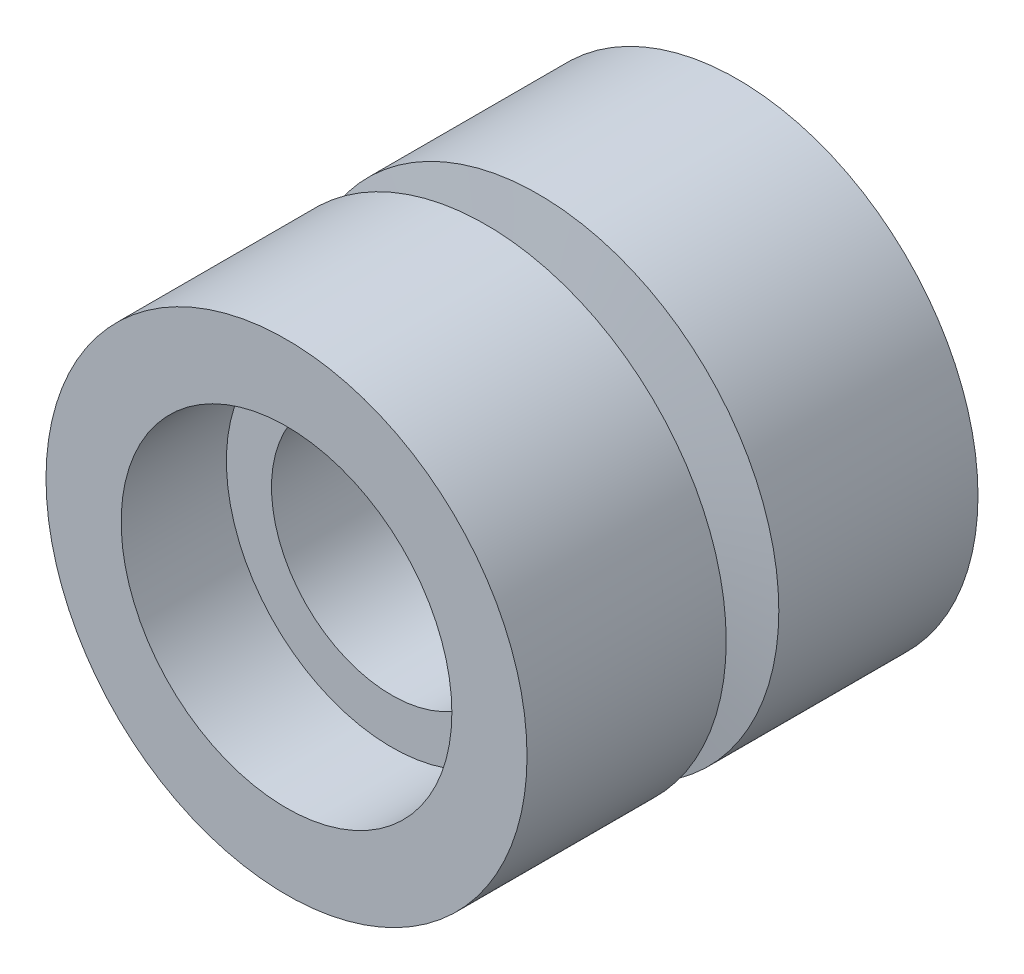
SolidWorks part; units mm, degrees
ref_plane "Plan de face" through (0, 0, 0) normal (0, 0, 1) x (1, 0, 0)
ref_plane "Plan de dessus" through (0, 0, 0) normal (0, 1, 0) x (1, 0, 0)
ref_plane "Plan de droite" through (0, 0, 0) normal (1, 0, 0) x (0, 0, -1)
sketch "Esquisse1" plane through (0, 0, 0) normal (1, 0, 0) x (0, 0, -1)
  line L0 (-21.7008, 0) -> (26.2005, 0) construction
  line L1 (-15, 11) -> (-15, 16)
  line L2 (-15, 16) -> (-1.75, 16)
  line L3 (-1.75, 16) -> (-1.1176, 11.5)
  line L4 (-1.1176, 11.5) -> (1.1176, 11.5)
  line L5 (1.1176, 11.5) -> (1.75, 16)
  line L6 (1.75, 16) -> (15, 16)
  line L7 (15, 16) -> (15, 11)
  line L8 (15, 11) -> (8, 11)
  line L9 (8, 11) -> (8, 8)
  line L10 (8, 8) -> (-8, 8)
  line L11 (-8, 8) -> (-8, 11)
  line L12 (-8, 11) -> (-15, 11)
  line L13 (0, 0) -> (0, 11.5) construction
  point P17 (-1.7177, 14.5396)
  point P18 (3.9368, -0.7826)
  point P19 (-3.1711, 5.0617)
  point P20 (3.1865, 4.8247)
  point P21 (2.9891, 1.8236)
  point P22 (-7.7517, 6.1673)
  point P23 (26.2005, 0)
  point P24 (-21.7008, 0)
  dimension "D1" = 32
  dimension "D2" = 4.5
  dimension "D3" = 98
  dimension "D4" = 3.5
  dimension "D5" = 30
  dimension "D6" = 7
  dimension "D7" = 22
  dimension "D8" = 3
revolve "Révolution1" add sketch "Esquisse1" angle 360 about L0
